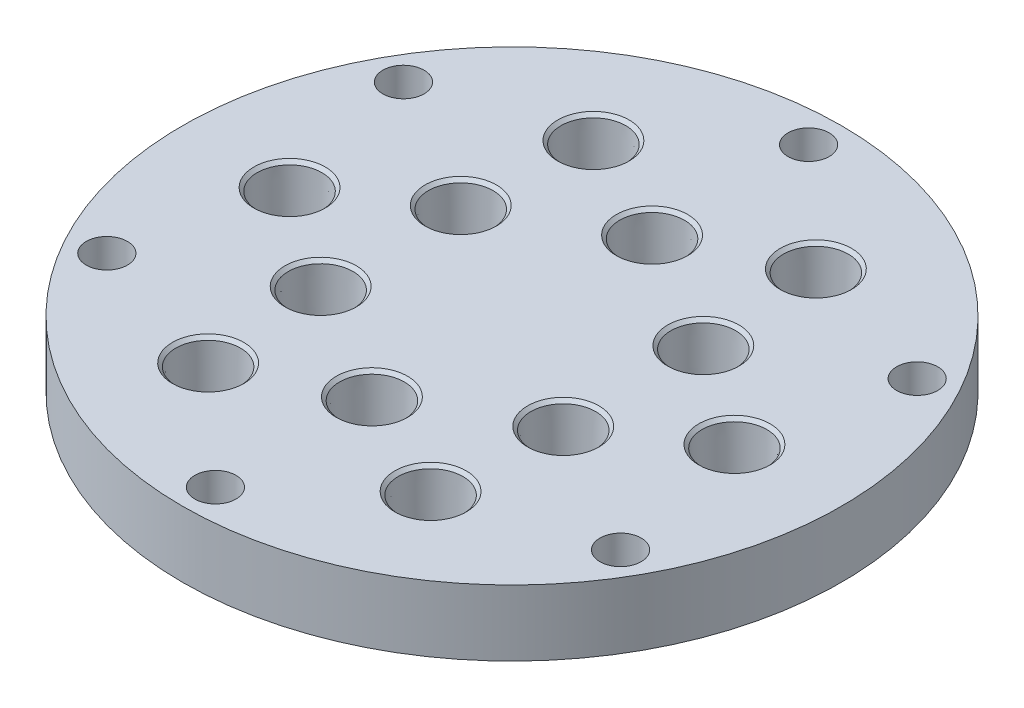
SolidWorks part; units mm, degrees
ref_plane "Front Plane" through (0, 0, 0) normal (0, 0, 1) x (1, 0, 0)
ref_plane "Top Plane" through (0, 0, 0) normal (0, 1, 0) x (1, 0, 0)
ref_plane "Right Plane" through (0, 0, 0) normal (1, 0, 0) x (0, 0, -1)
sketch "Sketch1" plane through (0, 0, 0) normal (0, 0, 1) x (1, 0, 0)
  line L0 (0, 0) -> (63.5, 0)
  line L1 (63.5, 0) -> (63.5, 12.7)
  line L2 (63.5, 12.7) -> (0, 12.7)
  line L3 (0, 12.7) -> (0, 0)
  line L4 (0, 0) -> (0, -17.913) construction
  dimension "D1" = 12.7
  dimension "D2" = 127
revolve "Revolve1" add sketch "Sketch1" angle 360 about L4
hole_wizard "5/16 (0.3125) Diameter Hole1" positions "Sketch3" profile "Sketch2" hole size "5/16" standard "Example Inch"
sketch "Sketch3" plane through (0, 12.7, 0) normal (0, 1, 0) x (-1, 0, 0)
  point P0 (0, 57.15)
  dimension "D1" = 57.15
sketch "Sketch2" plane through (0, 12.7, 57.15) normal (1, 0, 0) x (0, 0, 1)
  line L0 (0, 0) -> (0, 12.7)
  line L1 (0, 12.7) -> (3.9687, 12.7)
  line L2 (3.9687, 12.7) -> (3.9687, 0)
  line L5 (3.9687, 0) -> (0, 0)
  line L11 (0, -6.35) -> (0, 107.95) construction
  dimension "Thru Hole Dia." = 7.9375
  dimension "Thru Hole Depth" = 12.7
hole_wizard "1/4 NPT Tapped Hole1" positions "Sketch5" profile "Sketch4" size "1/4" standard "Ansi Inch"
sketch "Sketch5" plane through (0, 12.7, 0) normal (0, 1, 0) x (-1, 0, 0)
  point P0 (0, 26.9875)
  point P1 (-42.8625, 0)
  dimension "D1" = 42.8625
  dimension "D2" = 26.9875
sketch "Sketch4" plane through (0, 12.7, 26.9875) normal (1, 0, 0) x (0, 0, 1)
  line L0 (0, 0) -> (0, 20.3603)
  line L1 (5.5626, 17.018) -> (0, 20.3603)
  line L2 (-5.5626, 17.018) -> (0, 20.3603) construction
  line L3 (5.5626, 17.018) -> (5.5626, 9.906)
  line L4 (5.5626, 9.906) -> (5.9627, 9.906)
  line L5 (5.9627, 9.906) -> (6.2403, 0.635)
  line L6 (6.2403, 0.635) -> (6.8753, 0)
  line L7 (6.8753, 0) -> (0, 0)
  line L8 (0, -6.35) -> (0, 107.95) construction
  line L9 (-6.2403, 0.635) -> (-6.8753, 0) construction
  line L11 (-5.5626, 9.906) -> (-5.9627, 9.906) construction
  line L12 (-5.9627, 9.906) -> (-6.2403, 0.635) construction
  dimension "Tap Drill Dia." = 11.1252
  dimension "Tap Drill Depth" = 17.018
  dimension "Thread Dia." = 12.4806
  dimension "Thread Angle" = 3.43
  dimension "Thread Depth" = 9.906
  dimension "C'Sink Dia." = 13.7506
  dimension "C'Sink Angle" = 90
  dimension "Drill Angle" = 118
pattern_circular "CirPattern1" count 6 over 360 about axis through (0, 0, 0) along (0, 1, 0) of "1/4 NPT Tapped Hole1", "5/16 (0.3125) Diameter Hole1"
